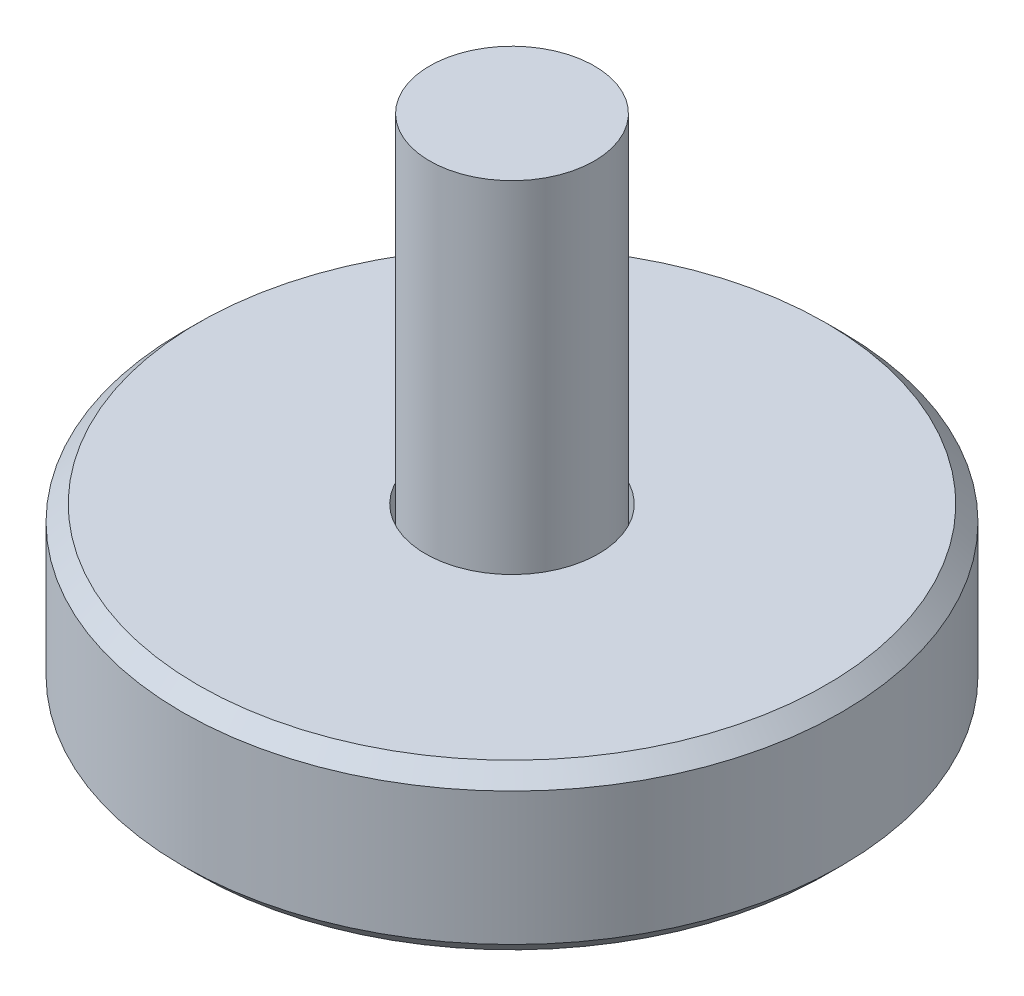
SolidWorks part; units mm, degrees
other "<FHCSM4L12>-<HEX>"
ref_plane "Front Plane" through (0, 0, 0) normal (0, 0, 1) x (1, 0, 0)
ref_plane "Top Plane" through (0, 0, 0) normal (0, 1, 0) x (1, 0, 0)
ref_plane "Right Plane" through (0, 0, 0) normal (1, 0, 0) x (0, 0, -1)
sketch "Sketch1" plane through (0, 0, 0) normal (0, 1, 0) x (1, 0, 0)
  circle A0 centre (0, 0) radius 8.001
  dimension "D1" = 16.002
extrude "Extrude1" add sketch "Sketch1" along normal blind 3.9878
chamfer "Chamfer1" distance 0.381 angle 45 2 edges at (0, 0, 8.001) (0, 3.9878, 8.001)
sketch "Sketch2" plane through (0, 0, 0) normal (0, 0, 1) x (1, 0, 0)
  line L0 (0, -2.05) -> (0, 7.8227) construction
  line L1 (0, 0) -> (4.5, 0)
  line L2 (-7.62, 0) -> (7.62, 0) construction
  line L3 (4.5, 0) -> (2.1, 2.4)
  line L4 (2.1, 2.4) -> (2.1, 3.9878)
  line L5 (7.62, 3.9878) -> (-7.62, 3.9878) construction
  line L6 (2.1, 3.9878) -> (0, 3.9878)
  line L7 (0, 3.9878) -> (0, 0)
  dimension "D1" = 4.2
  dimension "D2" = 2.4
  dimension "D3" = 45
revolve "Cut-Revolve1" cut sketch "Sketch2" angle 360 about L0
inserted part "FHCSM4L12"
move or copy body "Body-Move/Copy2" placed by mates yes
